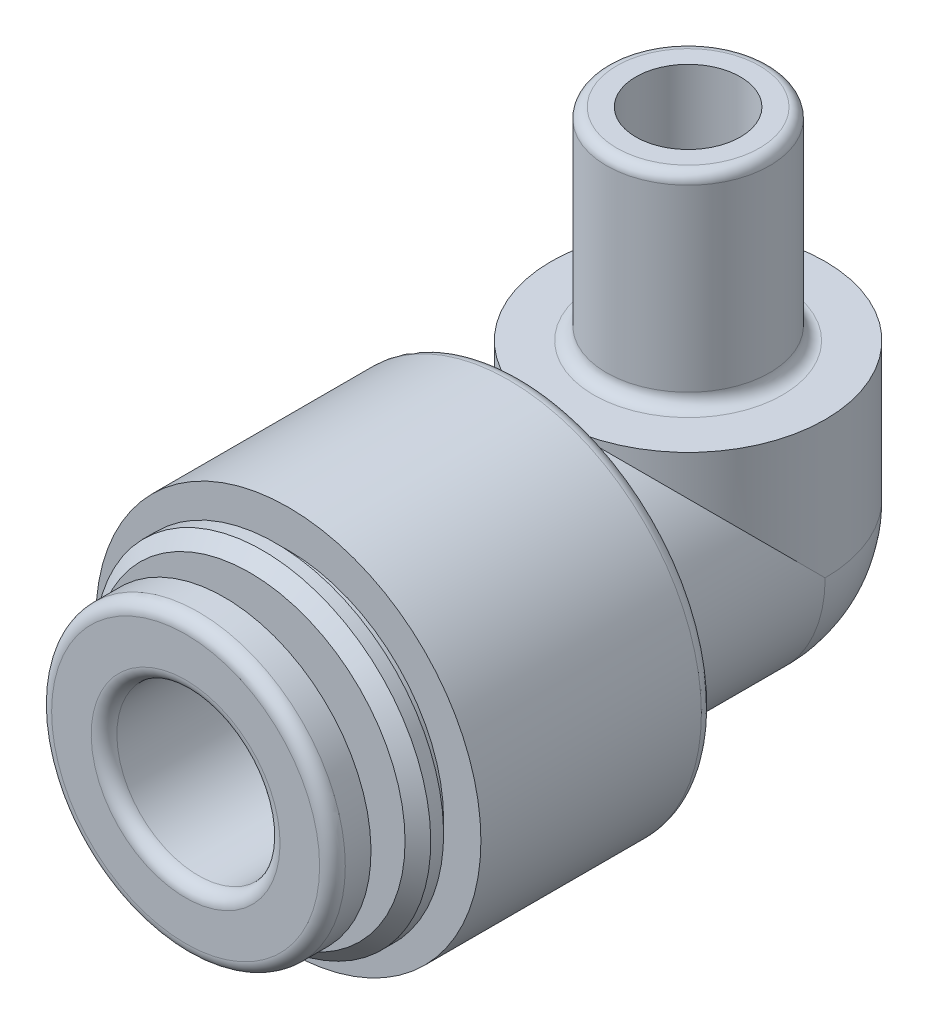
SolidWorks part; units mm, degrees
ref_plane "Front Plane" through (0, 0, 0) normal (0, 0, 1) x (1, 0, 0)
ref_plane "Top Plane" through (0, 0, 0) normal (0, 1, 0) x (1, 0, 0)
ref_plane "Right Plane" through (0, 0, 0) normal (1, 0, 0) x (0, 0, -1)
sketch "Sketch1" plane through (0, 0, 0) normal (1, 0, 0) x (0, 0, -1)
  line L0 (-19.558, 0) -> (0, 0) construction
  line L1 (-19.558, 3.175) -> (-19.558, -3.175) construction
  line L2 (-3.175, 23.368) -> (3.175, 23.368) construction
  line L4 (-5.334, 5.334) -> (5.334, 5.334) construction
  line L5 (0, 2.032) -> (0, -2.032) construction
  line L6 (-19.558, 7.493) -> (-19.558, -7.493) construction
  line L7 (0, 0) -> (0, 23.368) construction
  line L8 (-2.032, 0) -> (2.032, 0) construction
  line L10 (-5.334, 0) -> (5.334, 0) construction
  line L11 (0, 5.334) -> (0, -5.334) construction
  point P8 (0, 0)
  point P12 (-3.81, 0)
  point P26 (0, 5.334)
  dimension "A" = 24.892
  dimension "Tube OD" = 6.35
  dimension "D" = 18.034
  dimension "Insertion Depth" = 15.748
  dimension "F" = 4.064
  dimension "B" = 14.986
  dimension "C" = 10.668
  dimension "Stem OD" = 6.35
sketch "Sketch2" plane through (0, 0, 0) normal (1, 0, 0) x (0, 0, -1)
  line L0 (-19.558, 0) -> (0, 0)
  line L1 (0, 0) -> (0, 5.334)
  line L2 (-19.558, 0) -> (2.032, 0) construction
  line L3 (-6.977, 7.493) -> (-15.558, 7.493)
  line L4 (-17.058, 6.0405) -> (-16.558, 6.5405)
  line L5 (-17.058, 6.0405) -> (-17.058, 6.5405) construction
  line L6 (-17.058, 6.5405) -> (-16.558, 6.5405) construction
  line L7 (-17.058, 6.0405) -> (-17.058, 3.81)
  line L8 (-17.058, 3.81) -> (-18.058, 3.81)
  line L9 (-18.058, 3.81) -> (-18.058, 5.715)
  line L10 (-18.058, 5.715) -> (-19.558, 5.715)
  line L11 (-19.558, 5.715) -> (-19.558, 0)
  line L12 (-16.058, 6.5405) -> (-16.058, 6.0405)
  line L13 (-16.058, 6.0405) -> (-15.558, 6.0405)
  line L14 (-15.558, 6.0405) -> (-15.558, 7.493)
  line L15 (-16.058, 6.5405) -> (-16.558, 6.5405)
  line L16 (-6.477, 6.993) -> (-6.477, 5.584)
  line L17 (-6.227, 5.334) -> (0, 5.334)
  line L18 (0, 5.334) -> (5.334, 5.334) construction
  arc A0 (-6.477, 6.993) -> (-6.977, 7.493) centre (-6.977, 6.993) ccw
  arc A1 (-6.477, 5.584) -> (-6.227, 5.334) centre (-6.227, 5.584) ccw
  dimension "D9" = 0.5
  dimension "D10" = 0.25
  dimension "D1" = 13.081
  dimension "D4" = 1.5
  dimension "D2" = 11.43
  dimension "D3" = 7.62
  dimension "D5" = 1
  dimension "D6" = 0.5
  dimension "D8" = 13.081
revolve "Revolve1" add sketch "Sketch2" angle 360 about L0
sketch "Sketch3" plane through (0, 0, 0) normal (0, 0, -1) x (-1, 0, 0)
  line L0 (-5.334, 0) -> (5.334, 0)
  circle A1 centre (0, 0) radius 5.334
  arc A2 (-5.334, 0) -> (5.334, 0) centre (0, 0) ccw
  dimension "D1" = 0
revolve "Revolve2" add sketch "Sketch3" angle 90 about L0
sketch "Sketch4" plane through (0, 0, 0) normal (0, 1, 0) x (1, 0, 0)
  circle A0 centre (0, 0) radius 5.334
  arc A1 (5.334, 0) -> (-5.334, 0) centre (0, 0) ccw construction
extrude "Boss-Extrude1" add sketch "Sketch4" along normal up to vertex
sketch "Sketch5" plane through (0, 5.334, 0) normal (0, 1, 0) x (1, 0, 0)
  circle A0 centre (0, 0) radius 3.175
extrude "Boss-Extrude2" add sketch "Sketch5" along normal up to vertex
sketch "SketchA" plane through (0, 0, 0) normal (1, 0, 0) x (0, 0, -1)
  line L0 (-19.558, 3.175) -> (-3.81, 3.175)
  line L1 (-3.81, 3.175) -> (-3.81, 2.032)
  line L2 (-3.81, 2.032) -> (0, 2.032)
  line L3 (0, 2.032) -> (0, 0) construction
  line L5 (2.032, 0) -> (-19.558, 0)
  line L6 (-19.558, 0) -> (-19.558, 3.175)
  line L7 (-3.81, 0) -> (-3.81, 2.032) construction
  arc A0 (2.032, 0) -> (0, 2.032) centre (0, 0) ccw
revolve "Cut-Revolve2" cut sketch "SketchA" angle 360 about L5
fillet "Fillet1" radius 0.5 4 edges at (0, -5.715, 19.558) (0, 3.175, 19.558) (0, 23.368, 3.175) (0, 5.334, 3.175)
sketch "SketchX" plane through (0, 0, 0) normal (1, 0, 0) x (0, 0, -1)
  line L0 (-19.558, 3.175) -> (-3.81, 3.175)
  line L1 (-2.032, 2.032) -> (-3.81, 2.032)
  line L2 (-3.81, 2.032) -> (-3.81, 3.175)
  line L3 (-19.558, -3.175) -> (-3.81, -3.175)
  line L4 (0, -2.032) -> (-3.81, -2.032)
  line L5 (-3.81, -2.032) -> (-3.81, -3.175)
  line L6 (-2.032, 23.368) -> (-2.032, 2.032)
  line L8 (2.032, 23.368) -> (2.032, 0)
  line L9 (-3.175, 23.368) -> (3.175, 23.368) construction
  line L16 (-3.81, 3.175) -> (-3.81, -3.175) construction
  line L17 (0, 2.032) -> (-3.81, 2.032) construction
  arc A0 (2.032, 0) -> (0, -2.032) centre (0, 0) cw
sketch "Sketch6" plane through (0, 23.368, 0) normal (0, 1, 0) x (1, 0, 0)
  line L0 (0, -3.175) -> (0, 3.175) construction
  circle A0 centre (0, 0) radius 2.032
extrude "Cut-Extrude1" cut sketch "Sketch6" against normal up to vertex
sketch "Sketch7" plane through (0, 23.368, 0) normal (0, 1, 0) x (1, 0, 0)
  circle A0 centre (0, 0) radius 3.81
  dimension "D1" = 7.62
extrude "Cut-Extrude2" cut sketch "Sketch7" against normal blind 10.16
fillet "Fillet2" radius 0.3969 1 edges at (0, 13.208, 3.175)
equation "\"D1@Sketch2\" = \"B@Sketch1\" - 0.075"
equation "\"D2@Sketch2\" = \"Tube OD@Sketch1\" + 0.20"
equation "\"D3@Sketch2\" = \"Tube OD@Sketch1\" + 0.05"
equation "\"D8@Sketch2\" = \"B@Sketch1\" - 0.075"
